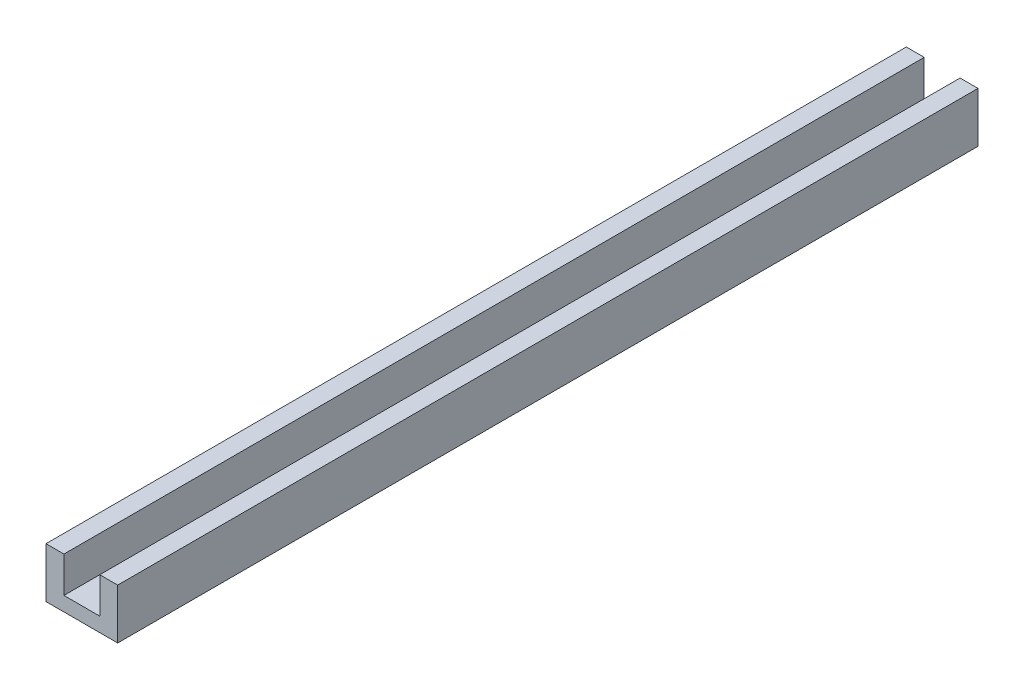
SolidWorks part; units mm, degrees
ref_plane "Front Plane" through (0, 0, 0) normal (0, 0, 1) x (1, 0, 0)
ref_plane "Top Plane" through (0, 0, 0) normal (0, 1, 0) x (1, 0, 0)
ref_plane "Right Plane" through (0, 0, 0) normal (1, 0, 0) x (0, 0, -1)
sketch "Sketch1" plane through (0, 0, 0) normal (0, 0, 1) x (1, 0, 0)
  line L0 (0, 0) -> (0, 17.78)
  line L1 (0, 17.78) -> (6.35, 17.78)
  line L2 (6.35, 17.78) -> (6.35, 5.08)
  line L3 (6.35, 5.08) -> (19.05, 5.08)
  line L4 (19.05, 5.08) -> (19.05, 17.78)
  line L5 (19.05, 17.78) -> (25.4, 17.78)
  line L6 (25.4, 17.78) -> (25.4, 0)
  line L7 (25.4, 0) -> (0, 0)
  point P4 (3.175, 17.78)
  dimension "D1" = 25.4
  dimension "D2" = 6.35
  dimension "D3" = 12.7
  dimension "D4" = 12.7
  dimension "D5" = 5.08
extrude "Boss-Extrude1" add sketch "Sketch1" along normal mid plane 304.8 contours L0 L1 L2 L3 L4 L5 L6 L7
